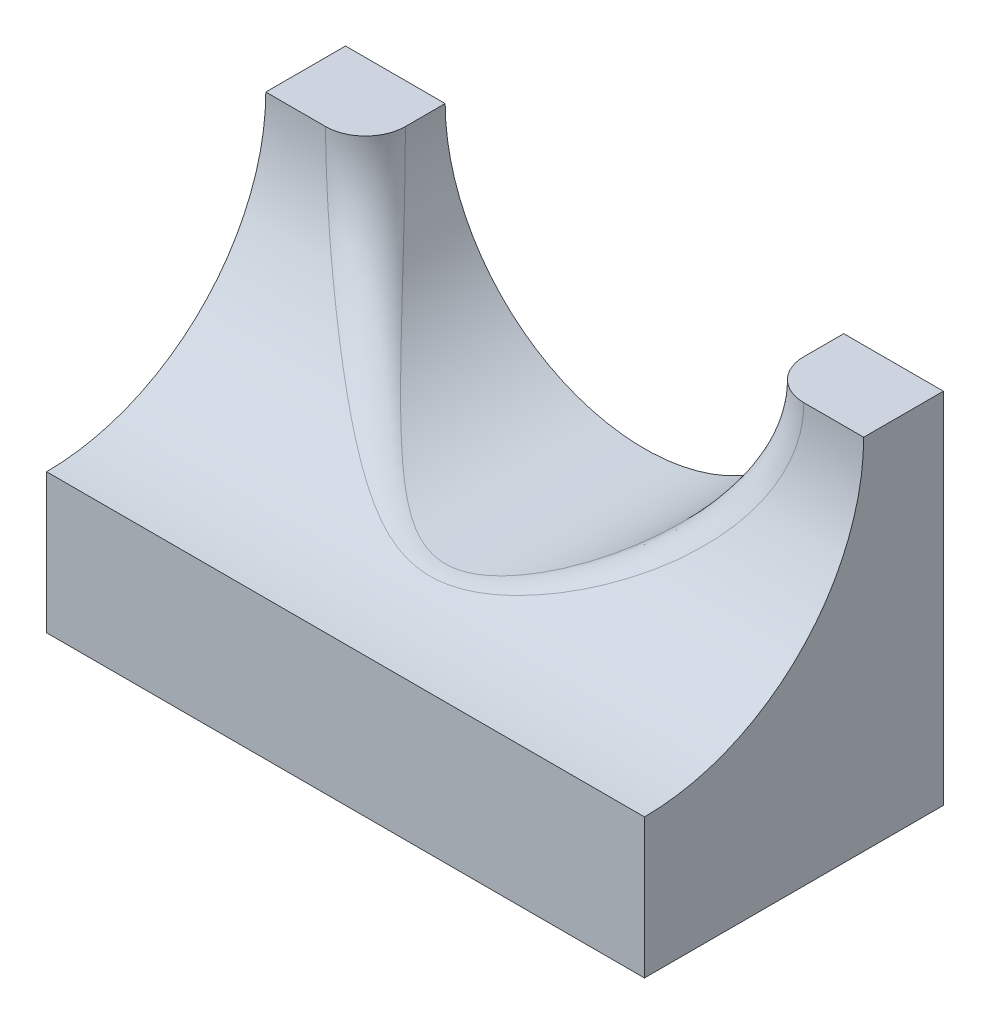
SolidWorks part; units mm, degrees
ref_plane "Front Plane" through (0, 0, 0) normal (0, 0, 1) x (1, 0, 0)
ref_plane "Top Plane" through (0, 0, 0) normal (0, 1, 0) x (1, 0, 0)
ref_plane "Right Plane" through (0, 0, 0) normal (1, 0, 0) x (0, 0, -1)
sketch "Sketch1" plane through (0, 0, 0) normal (1, 0, 0) x (0, 0, -1)
  line L1 (0, 0) -> (47.625, 0)
  line L2 (0, 0) -> (0, 57.15)
  line L3 (0, 57.15) -> (47.625, 57.15)
  line L4 (47.625, 0) -> (47.625, 57.15)
  dimension "D1" = 47.625
  dimension "D2" = 57.15
extrude "Extrude1" add sketch "Sketch1" along normal blind 95.25
sketch "Sketch2" plane through (95.25, 0, 0) normal (1, 0, 0) x (0, 0, -1)
  circle A0 centre (0, 57.15) radius 34.925
  dimension "D1" = 34.925
extrude "Cut-Extrude1" cut sketch "Sketch2" against normal through all
sketch "Sketch3" plane through (0, 0, -47.625) normal (0, 0, -1) x (-1, 0, 0)
  line L0 (-95.25, 57.15) -> (0, 57.15) construction
  circle A0 centre (-47.625, 57.15) radius 31.75
  dimension "D1" = 31.75
extrude "Cut-Extrude2" cut sketch "Sketch3" against normal through all
fillet "Fillet1" radius 6.35 1 edges at (48.6001, 25.415, -14.5823)
